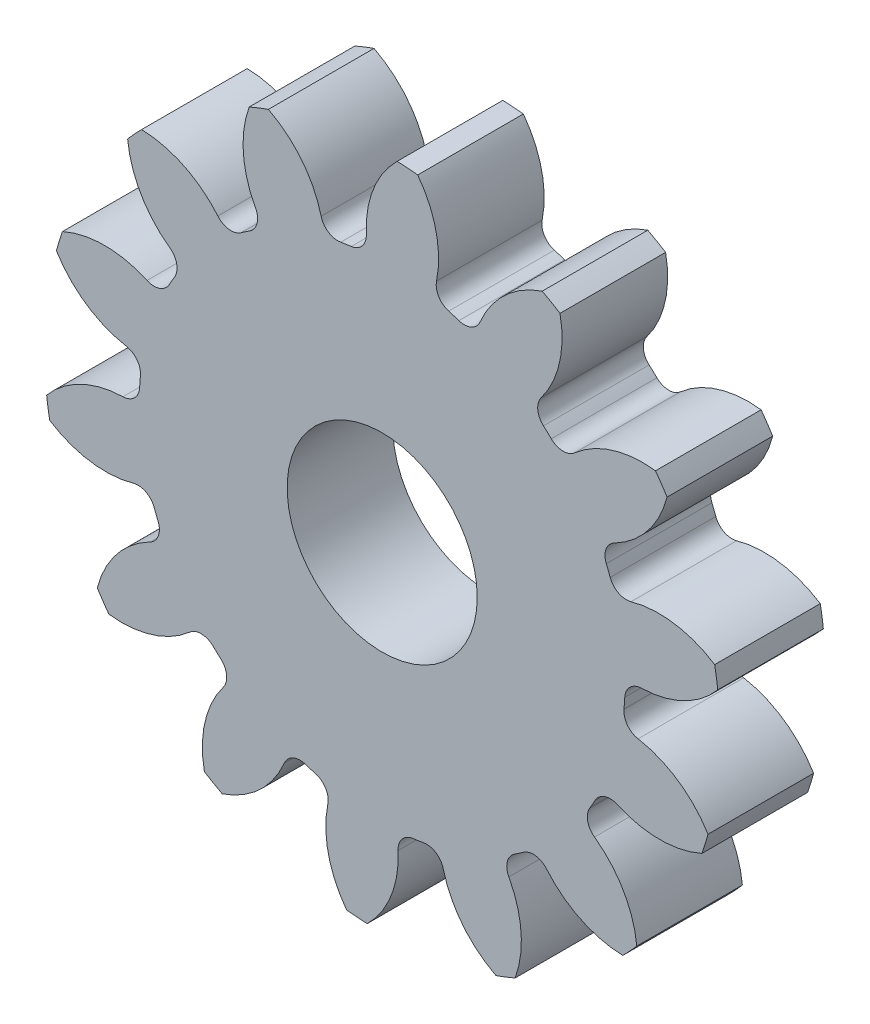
SolidWorks part; units mm, degrees
ref_plane "Front" through (0, 0, 0) normal (0, 0, 1) x (1, 0, 0)
ref_plane "Top" through (0, 0, 0) normal (0, 1, 0) x (1, 0, 0)
ref_plane "Right" through (0, 0, 0) normal (1, 0, 0) x (0, 0, -1)
sketch "Sketch3" plane through (0, 0, 0) normal (0, 0, 1) x (1, 0, 0)
  circle A0 centre (0, 0) radius 406.4
  dimension "od" = 812.8
extrude "gearBody" add sketch "Sketch3" along normal blind 127
sketch "Sketch2" plane through (0, 0, 0) normal (0, 0, 1) x (1, 0, 0)
  line L0 (0, 0) -> (308.7187, 127.8755) construction
  line L1 (394.1184, -111.8878) -> (0, 0) construction
  line L2 (0, 0) -> (36.3143, 0) construction
  line L3 (355.3546, 13.2092) -> (349.4072, -66.0755) construction
  line L5 (352.3809, -26.4332) -> (0, 0) construction
  line L7 (0, 0) -> (334.1547, 0) construction
  arc A0 (334.0872, 6.7157) -> (329.3466, -56.4818) centre (0, 0) ccw construction
  arc A1 (403.5221, 48.2791) -> (391.8037, -107.939) centre (0, 0) ccw construction
  arc A2 (355.3546, 13.2092) -> (349.4072, -66.0755) centre (0, 0) ccw construction
  arc A3 (290.7316, -28.2408) -> (291.6912, -15.4485) centre (0, 0) ccw
  arc A4 (394.1184, -111.8878) -> (307.7146, -50.6003) centre (286.1865, -172.5011) ccw
  arc A5 (394.1184, -111.8878) -> (406.4, 51.8385) centre (0, 0) ccw
  arc A6 (406.4, 51.8385) -> (311.8199, 4.1272) centre (308.7187, 127.8755) cw
  arc A7 (291.6912, -15.4485) -> (311.8199, 4.1272) centre (312.3379, -16.542) cw
  arc A8 (307.7146, -50.6003) -> (290.7316, -28.2408) centre (311.3103, -30.2398) cw
  point P6 (406.4, 51.8385)
  point P22 (394.1184, -111.8878)
  dimension "baseDia" = 668.3094
  dimension "od" = 812.8
  dimension "pd" = 711.2
  dimension "rd" = 584.2
  dimension "rFillet" = 20.6756
  dimension "pointX" = 406.4
  dimension "pointY" = 51.8385
  dimension "CTT" = 79.2847
  dimension "flankCenterAngle" = 22.5
extrude "toothCut" cut sketch "Sketch2" along normal through all
pattern_circular "CirPattern1" count 14 over 360 about axis through (0, 0, 0) along (0, 0, 1) of "toothCut"
sketch "hub1Dia" plane through (0, 0, 0) normal (0, 0, -1) x (-1, 0, 0)
  circle A0 centre (0, 0) radius 12.7
  dimension "hub1Dia" = 25.4
sketch "hub2Dia" plane through (0, 0, 127) normal (0, 0, 1) x (1, 0, 0)
  circle A0 centre (0, 0) radius 12.7
  dimension "hub2dia" = 25.4
sketch "boreDia" plane through (0, 0, 0) normal (0, 0, 1) x (1, 0, 0)
  circle A0 centre (0, 0) radius 114.3
  dimension "boreDia" = 228.6
extrude "bore" cut sketch "boreDia" against normal mid plane 25400
